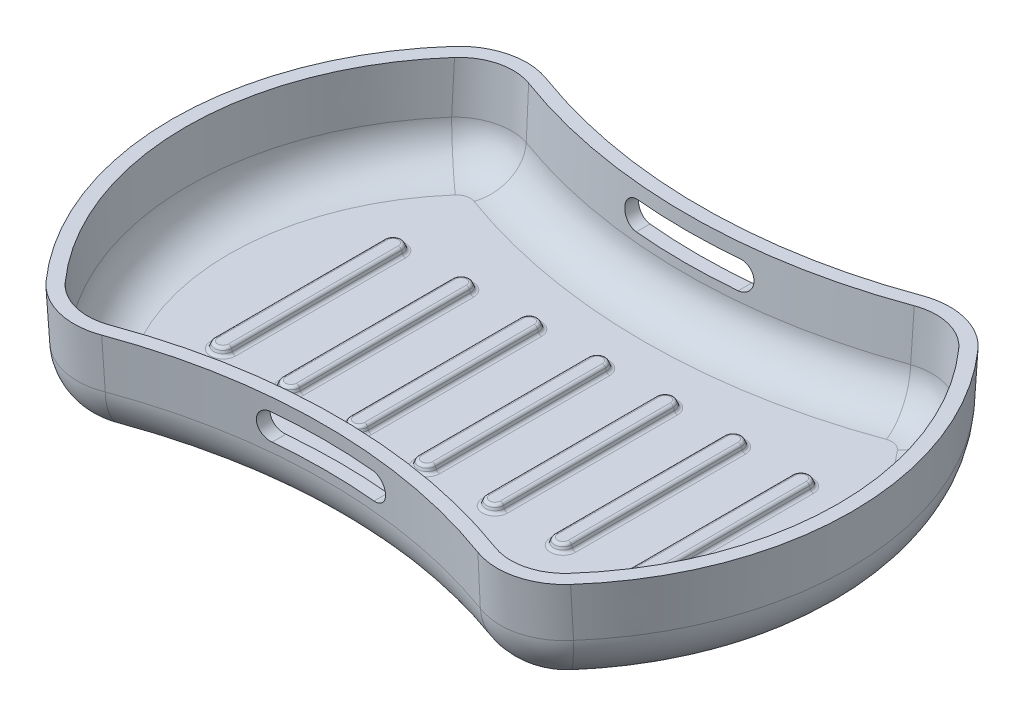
SolidWorks part; units mm, degrees
ref_plane "Front" through (0, 0, 0) normal (0, 0, 1) x (1, 0, 0)
ref_plane "Top" through (0, 0, 0) normal (0, 1, 0) x (1, 0, 0)
ref_plane "Right" through (0, 0, 0) normal (1, 0, 0) x (0, 0, -1)
sketch "Sketch1" plane through (0, 0, 0) normal (0, 1, 0) x (1, 0, 0)
  line L0 (-50, 0) -> (50, 0) construction
  line L1 (-50, -35) -> (50, -35) construction
  line L2 (-50, -35) -> (-50, 35) construction
  line L3 (-50, 35) -> (50, 35) construction
  line L4 (50, -35) -> (50, 35) construction
  line L5 (-50, -35) -> (50, 35) construction
  line L6 (-50, 35) -> (50, -35) construction
  arc A0 (-33.2843, -35) -> (-33.2843, 35) centre (-5, 0) cw
  arc A1 (-33.2843, 35) -> (33.2843, 35) centre (0, 107.7472) ccw
  arc A2 (33.2843, 35) -> (33.2843, -35) centre (5, 0) cw
  arc A3 (-33.2843, -35) -> (33.2843, -35) centre (0, -107.7472) cw
  point P0 (0, 0)
  point P13 (0, 27.7472)
  dimension "D3" = 45
  dimension "D4" = 80
  dimension "D1" = 100
  dimension "D2" = 70
extrude "Boss-Extrude1" add sketch "Sketch1" against normal blind 15 draft 3
fillet "Fillet3" radius 10 4 edges
fillet "Fillet4" radius 8 8 edges at (-34.1009, -15, 31.8472) (0, -15, 26.9611) (32.7033, -15, 32.2118) (49.2139, -15, 0) (34.1009, -15, -31.8472) (0, -15, -26.9611) (-32.7033, -15, -32.2118) (-49.2139, -15, 0)
shell "Shell1" thickness 2
sketch "Sketch2" plane through (0, -15, 0) normal (0, -1, 0) x (1, 0, 0)
  line L1 (-30, -20) -> (30, -20) construction
  line L2 (-30, -20) -> (-30, 20) construction
  line L3 (-30, 20) -> (30, 20) construction
  line L4 (30, -20) -> (30, 20) construction
  line L5 (-30, -20) -> (30, 20) construction
  line L6 (-30, 20) -> (30, -20) construction
  circle A0 centre (30, 20) radius 2.5
  circle A1 centre (30, -20) radius 2.5
  circle A2 centre (-30, 20) radius 2.5
  circle A3 centre (-30, -20) radius 2.5
  point P8 (0, 0)
  dimension "D1" = 5
  dimension "D2" = 60
  dimension "D3" = 40
extrude "Boss-Extrude2" add sketch "Sketch2" along normal blind 1 draft 3
fillet "Fillet5" radius 0.25 8 edges at (-30, -16, -22.4476) (30, -16, -22.4476) (30, -16, 17.5524) (30, -15, 22.5) (30, -15, -17.5) (-30, -15, -17.5) (-30, -16, 17.5524) (-30, -15, 22.5)
sketch "Sketch3" plane through (0, -13, 0) normal (0, 1, 0) x (1, 0, 0)
  line L0 (-58.5802, 0) -> (61.1599, 0) construction
  line L1 (-30, -12.5) -> (-30, 12.5) construction
  line L2 (-31.5, -12.5) -> (-31.5, 12.5)
  line L3 (-28.5, -12.5) -> (-28.5, 12.5)
  arc A0 (-31.5, -12.5) -> (-28.5, -12.5) centre (-30, -12.5) ccw
  arc A1 (-28.5, 12.5) -> (-31.5, 12.5) centre (-30, 12.5) ccw
  point P4 (-30, 0)
  dimension "D1" = 3
  dimension "D2" = 25
  dimension "D3" = 30
extrude "Boss-Extrude3" add sketch "Sketch3" along normal blind 1 draft 20
fillet "Fillet6" radius 0.5 8 edges at (-30, -12, -13.636) (-28.864, -12, 0) (-30, -12, 13.636) (-30, -13, -14) (-28.5, -13, 0) (-30, -13, 14) (-31.136, -12, 0) (-31.5, -13, 0)
pattern_linear "LPattern1" count 7 spacing 10 along (1, 0, 0) of "Boss-Extrude3", "Fillet6"
sketch "Sketch4" plane through (0, 0, 0) normal (0, 1, 0) x (1, 0, 0)
  line L1 (-75.8733, -56.6161) -> (75.8733, -56.6161)
  line L2 (-75.8733, -56.6161) -> (-75.8733, 56.6161)
  line L3 (-75.8733, 56.6161) -> (75.8733, 56.6161)
  line L4 (75.8733, -56.6161) -> (75.8733, 56.6161)
  line L5 (-75.8733, -56.6161) -> (75.8733, 56.6161) construction
  line L6 (-75.8733, 56.6161) -> (75.8733, -56.6161) construction
  point P0 (0, 0)
sketch "Sketch5" plane through (0, 0, 0) normal (0, 0, 1) x (1, 0, 0)
  line L0 (-7.5, -4) -> (7.5, -4) construction
  line L1 (-7.5, -2) -> (7.5, -2)
  line L2 (-7.5, -6) -> (7.5, -6)
  arc A0 (-7.5, -2) -> (-7.5, -6) centre (-7.5, -4) ccw
  arc A1 (7.5, -6) -> (7.5, -2) centre (7.5, -4) ccw
  point P2 (0, -4)
  dimension "D1" = 4
  dimension "D2" = 2
  dimension "D3" = 15
extrude "Cut-Extrude1" cut sketch "Sketch5" against normal through all both and the other way through all
